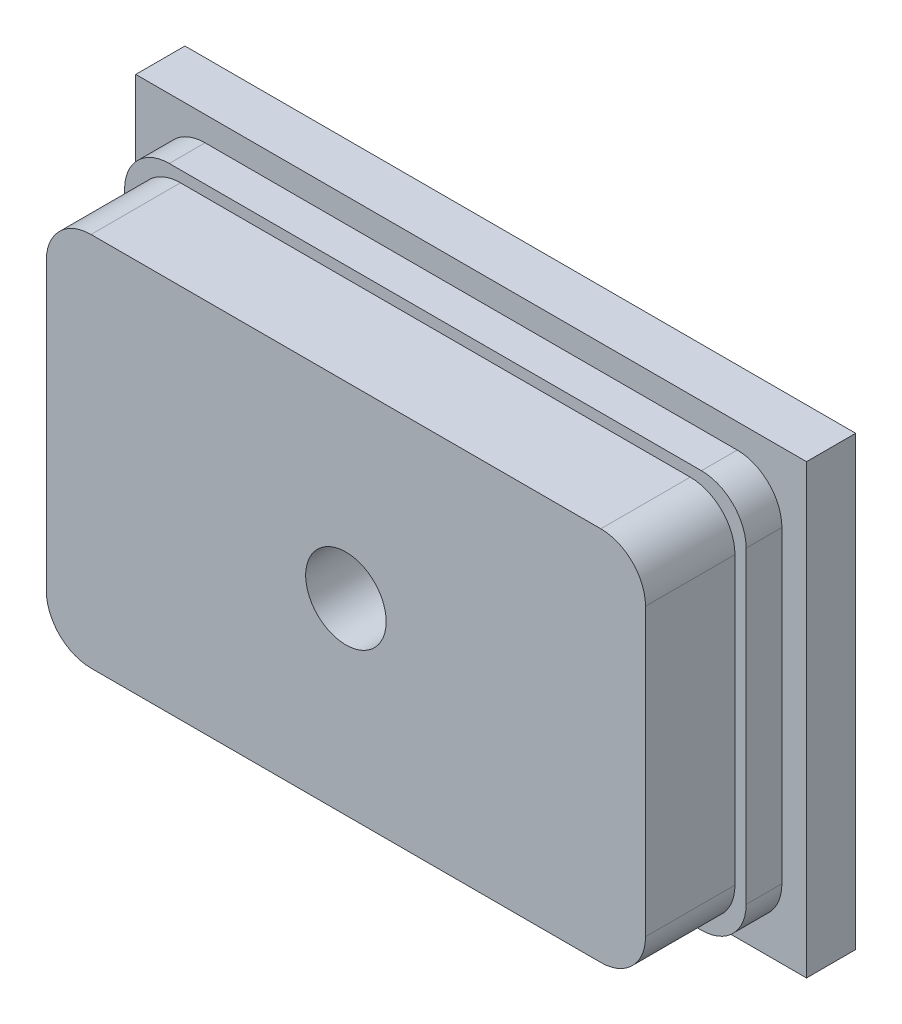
SolidWorks part; units mm, degrees
ref_plane "Plan de face" through (0, 0, 0) normal (0, 0, 1) x (1, 0, 0)
ref_plane "Plan de dessus" through (0, 0, 0) normal (0, 1, 0) x (1, 0, 0)
ref_plane "Plan de droite" through (0, 0, 0) normal (1, 0, 0) x (0, 0, -1)
sketch "Esquisse1" plane through (0, 0, 0) normal (0, 0, 1) x (1, 0, 0)
  line L1 (-69.5, -44.5) -> (69.5, -44.5)
  line L2 (-69.5, -44.5) -> (-69.5, 44.5)
  line L3 (-69.5, 44.5) -> (69.5, 44.5)
  line L4 (69.5, -44.5) -> (69.5, 44.5)
  dimension "D1" = 89
  dimension "D2" = 139
  dimension "D3" = 44.5
  dimension "D4" = 69.5
extrude "Extrusion1" add sketch "Esquisse1" along normal blind 8
sketch "Esquisse2" plane through (0, 0, 8) normal (0, 0, 1) x (1, 0, 0)
  line L1 (-67, 42) -> (67, 42)
  line L2 (-67, 42) -> (-67, -42)
  line L3 (-67, -42) -> (67, -42)
  line L4 (67, 42) -> (67, -42)
  dimension "D1" = 134
  dimension "D2" = 84
  dimension "D3" = 67
  dimension "D4" = 42
extrude "Extrusion2" add sketch "Esquisse2" along normal blind 20
fillet "Congé1" radius 10 4 edges at (-67, 42, 18) (-67, -42, 18) (67, 42, 18) (67, -42, 18)
fillet "Congé2" radius 10 4 edges at (69.5, 44.5, 4) (69.5, -44.5, 4) (-69.5, 44.5, 4) (-69.5, -44.5, 4)
sketch "Esquisse3" plane through (0, 0, 28) normal (0, 0, 1) x (1, 0, 0)
  circle A0 centre (0, 0) radius 9
  dimension "D1" = 18
sketch "Esquisse15" plane through (0, 0, 0) normal (0, 0, -1) x (-1, 0, 0)
  line L1 (75, -50) -> (-75, -50)
  line L2 (75, -50) -> (75, 50)
  line L3 (75, 50) -> (-75, 50)
  line L4 (-75, -50) -> (-75, 50)
  dimension "D1" = 100
  dimension "D2" = 50
  dimension "D3" = 150
  dimension "D4" = 75
extrude "Extrusion3" add sketch "Esquisse15" along normal blind 11
extrude "Enlèv. mat.-Extru.1" cut sketch "Esquisse3" against normal blind 28
